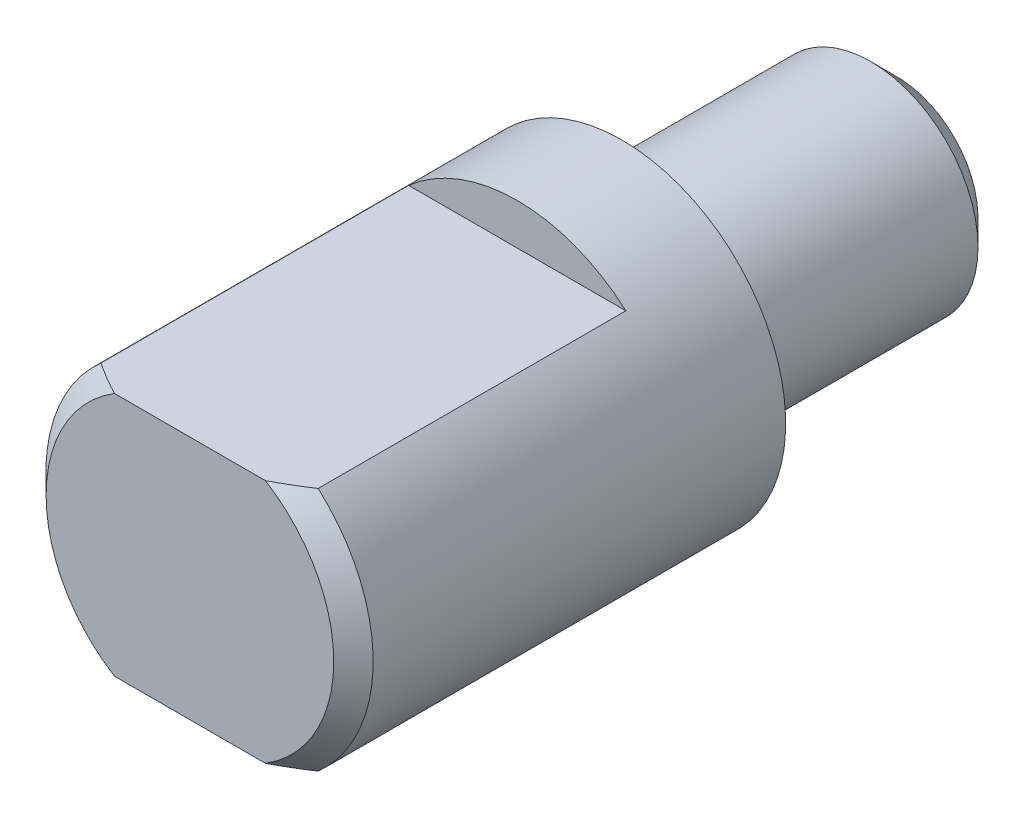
SolidWorks part; units mm, degrees
ref_plane "Front" through (0, 0, 0) normal (0, 0, 1) x (1, 0, 0)
ref_plane "Top" through (0, 0, 0) normal (0, 1, 0) x (1, 0, 0)
ref_plane "Right" through (0, 0, 0) normal (1, 0, 0) x (0, 0, -1)
sketch "Sketch1" plane through (0, 0, 0) normal (1, 0, 0) x (0, 0, -1)
  line L0 (9.652, 1.57) -> (9.142, 2.0828)
  line L1 (-4.064, 0) -> (9.652, 0)
  line L2 (-4.064, 0) -> (-4.064, 2.79)
  line L3 (-3.684, 3.175) -> (4.318, 3.175)
  line L4 (4.318, 2.0828) -> (4.318, 3.175)
  line L5 (153.7208, 0) -> (-49846.2792, 0) construction
  line L6 (-4.064, 2.79) -> (-3.684, 3.175)
  line L7 (4.318, 2.0828) -> (9.142, 2.0828)
  line L8 (9.652, 0) -> (9.652, 1.57)
  dimension "D1" = 8.382
  dimension "D2" = 3.175
  dimension "D3" = 4.1656
  dimension "D4" = 5.334
  dimension "D5" = 1.57
  dimension "D6" = 0.51
  dimension "D7" = 2.79
  dimension "D8" = 0.38
  dimension "D9" = 4.064
revolve "Revolve1" add sketch "Sketch1" angle 360 about L1
sketch "Sketch2" plane through (0, 0, 0) normal (1, 0, 0) x (0, 0, -1)
  line L0 (-4.064, 2.79) -> (-4.064, -2.79) construction
  line L1 (-4.064, 2.375) -> (2.286, 2.375)
  line L2 (-4.064, 2.375) -> (-4.064, 3.175)
  line L3 (-4.064, 3.175) -> (2.286, 3.175)
  line L4 (2.286, 2.375) -> (2.286, 3.175)
  line L5 (4.318, 3.175) -> (-3.684, 3.175) construction
  line L6 (0, 0) -> (6.0811, 0) construction
  line L7 (2.286, -2.375) -> (2.286, -3.175)
  line L8 (-4.064, -3.175) -> (2.286, -3.175)
  line L9 (-4.064, -2.375) -> (-4.064, -3.175)
  line L10 (-4.064, -2.375) -> (2.286, -2.375)
  dimension "D1" = 0.8
  dimension "D2" = 6.35
extrude "Cut-Extrude1" cut sketch "Sketch2" against normal mid plane 10
